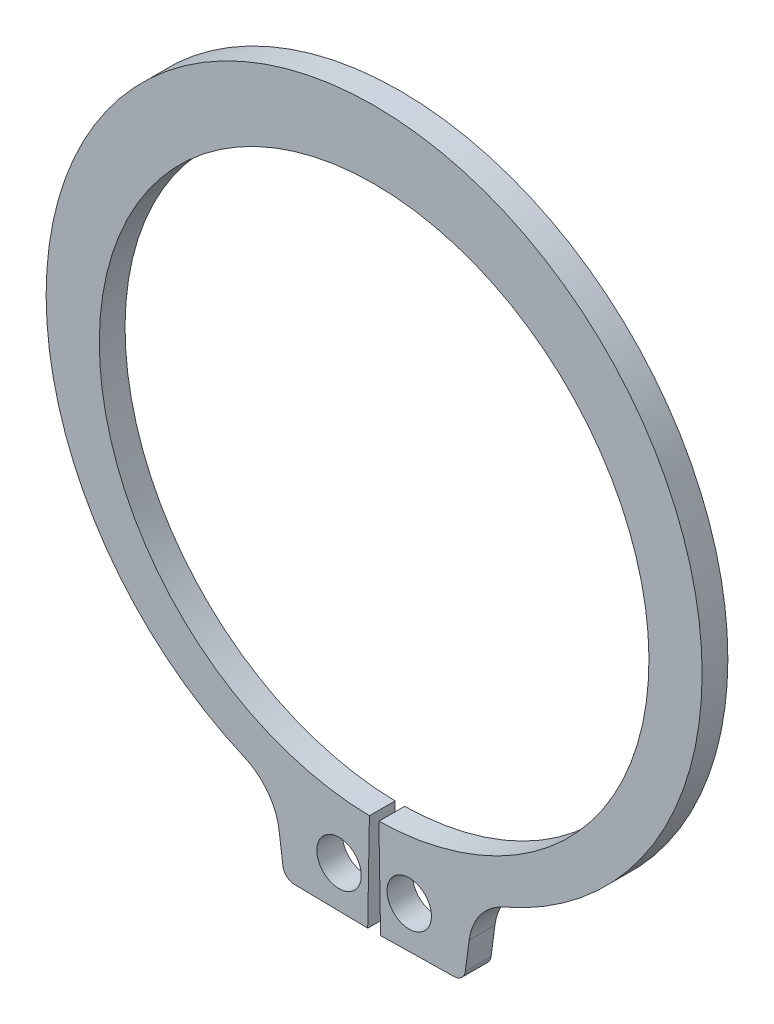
SolidWorks part; units mm, degrees
ref_plane "Plane1" through (0, 0, 0) normal (0, 0, 1) x (1, 0, 0)
ref_plane "Plane2" through (0, 0, 0) normal (0, 1, 0) x (1, 0, 0)
ref_plane "Plane3" through (0, 0, 0) normal (1, 0, 0) x (0, 0, -1)
extrude "Body" add sketch "BodySke" against normal blind 1.1
sketch "BodySke" plane through (0, 0, 0) normal (0, 0, 1) x (1, 0, 0)
  line L0 (-1.5431, 0) -> (1.5431, 0) construction
  line L1 (0, 0) -> (0, 14.65) construction
  line L2 (0.2026, -11.7483) -> (0.275, -15.9476)
  line L3 (-0.2026, -11.7483) -> (-0.275, -15.9476)
  line L4 (0, 0) -> (6.5413, -14.547) construction
  line L5 (0, 0) -> (-6.5413, -14.547) construction
  line L6 (0.275, -15.9476) -> (3.4129, -15.8935)
  line L7 (4.063, -14.2207) -> (3.9, -15.4589)
  line L8 (-4.063, -14.2207) -> (-3.9, -15.4589)
  line L9 (-0.275, -15.9476) -> (-3.4129, -15.8935)
  circle A0 centre (0, 0) radius 11.75 construction
  arc A1 (0.2026, -11.7483) -> (-0.2026, -11.7483) centre (0, 0) ccw
  arc A2 (5.516, -12.2669) -> (-5.516, -12.2669) centre (0, 0.6264) ccw construction
  arc A3 (0.275, -15.9476) -> (3.9942, -15.4418) centre (0, 0) ccw construction
  arc A4 (5.5517, -12.2515) -> (4.063, -14.2207) centre (6.5413, -14.547) ccw
  arc A5 (-4.063, -14.2207) -> (-5.5517, -12.2515) centre (-6.5413, -14.547) ccw
  arc A6 (-3.9942, -15.4418) -> (-0.275, -15.9476) centre (0, 0) ccw construction
  arc A7 (5.5517, -12.2515) -> (-5.5517, -12.2515) centre (0, 0.6264) ccw
  arc A8 (-4.1437, -13.6081) -> (4.1437, -13.6081) centre (0, 0) ccw construction
  circle A9 centre (1.5, -14.1457) radius 0.95
  circle A10 centre (-1.5, -14.1457) radius 0.95
  arc A11 (3.9, -15.4589) -> (3.4129, -15.8935) centre (3.4043, -15.3936) cw
  arc A12 (-3.9, -15.4589) -> (-3.4129, -15.8935) centre (-3.4043, -15.3936) ccw
  point P28 (3.8991, -15.4661)
  point P31 (-3.8991, -15.4661)
  dimension "GrooveDia" = 23.5
  dimension "D3" = 0.5
  dimension "LugRad" = 15.95
  dimension "HoleOffsetRad" = 14.225
  dimension "HoleDia" = 1.9
  dimension "D2" = 15
  dimension "LargeRad" = 14.65
  dimension "SmallRad" = 13.45
  dimension "Gap" = 0.55
  dimension "SmallAngle" = 48.424
  dimension "HoleSpacing" = 3
sketch "Clipboard" plane through (0, 0, 0) normal (0, 0, 1) x (1, 0, 0)
  line L0 (0, 0) -> (2.9, 0)
  line L1 (0, 0) -> (0, 1.7)
  line L2 (0, 0) -> (0, -4.2)
  circle A0 centre (0, 0) radius 0.95
  circle A1 centre (0, 0) radius 12.5
  dimension "HoleDia" = 1.9
  dimension "ShaftDia" = 25
  dimension "LargeSection" = 2.9
  dimension "SmallSection" = 1.7
  dimension "LugSection" = 4.2
sketch "NotSke" plane through (0, 0, 0) normal (0, 0, 1) x (1, 0, 0)
  line L0 (1.5, -13.1957) -> (1.5, -15.0957)
  line L1 (1.5, -15.0957) -> (-1.5, -15.0957)
  line L2 (-1.5, -15.0957) -> (-1.5, -13.1957)
  line L3 (-1.5, -13.1957) -> (1.5, -13.1957)
  circle A0 centre (1.5, -14.1457) radius 0.95 construction
  circle A1 centre (-1.5, -14.1457) radius 0.95 construction
extrude "Notch" [suppressed] cut sketch "NotSke" against normal through all
equation "' \"ShaftDia@Clipboard\" = 4"
equation "' \"Thickness@Body\" = 0.25"
equation "' \"GrooveDia@BodySke\" = 3.8"
equation "' \"LugSection@Clipboard\" = 1.35"
equation "' \"LargeSection@Clipboard\" = 0.65"
equation "' \"SmallSection@Clipboard\" = 0.4"
equation "' \"HoleDia@Clipboard\" = 0.6"
equation "' \"ShaftDia@Clipboard\" = 15"
equation "' \"Thickness@Body\" = 0.9"
equation "' \"GrooveDia@BodySke\" = 14.15"
equation "' \"LugSection@Clipboard\" = 2.8"
equation "' \"LargeSection@Clipboard\" = 1.8"
equation "' \"SmallSection@Clipboard\" = 1.05"
equation "' \"HoleDia@Clipboard\" = 1.2"
equation "\"Gap@BodySke\" =  \"Thickness@Body\" / 2"
equation "\"LargeRad@BodySke\" =  \"GrooveDia@BodySke\" / 2 +  \"LargeSection@Clipboard\""
equation "\"SmallRad@BodySke\" =  \"GrooveDia@BodySke\" / 2 +  \"SmallSection@Clipboard\""
equation "\"LugRad@BodySke\" = \"GrooveDia@BodySke\" / 2 + \"LugSection@Clipboard\""
equation "\"HoleOffsetRad@BodySke\" = (  \"ShaftDia@Clipboard\" / 2 + \"LugRad@BodySke\" ) / 2"
equation "\"HoleSpacing@BodySke\" = \"Gap@BodySke\"  * 2 +  \"HoleDia@Clipboard\""
equation "\"HoleDia@BodySke\" =  \"HoleDia@Clipboard\""
equation "\"SmallAngle@BodySke\" = atn(\"HoleSpacing@BodySke\" / 2 / sqr(\"HoleOffsetRad@BodySke\"  * \"HoleOffsetRad@BodySke\" - (\"HoleSpacing@BodySke\" / 2) * (\"HoleSpacing@BodySke\" / 2) ))  * 8 * ( 180 / 3.141593)"
